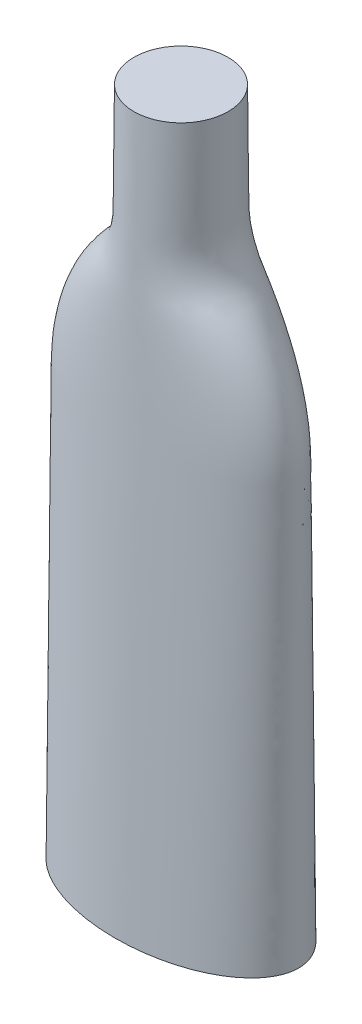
SolidWorks part; units mm, degrees
ref_plane "Front Plane" through (0, 0, 0) normal (0, 0, 1) x (1, 0, 0)
ref_plane "Top Plane" through (0, 0, 0) normal (0, 1, 0) x (1, 0, 0)
ref_plane "Right Plane" through (0, 0, 0) normal (1, 0, 0) x (0, 0, -1)
ref_plane "Plane1" through (0, 150, 0) normal (0, 1, 0) x (-1, 0, 0)
sketch "Sketch1" plane through (0, 0, 0) normal (0, 1, 0) x (1, 0, 0)
  ellipse E0 centre (0, 0) end of major axis (25, 0) minor radius 14
  dimension "D1" = 28
  dimension "D2" = 50
sketch "Sketch2" plane through (0, 150, 0) normal (0, 1, 0) x (-1, 0, 0)
  circle A0 centre (0, 0) radius 10
  dimension "D1" = 20
sketch "Sketch3" plane through (-0.4042, 0, 0) normal (0, 0, -1) x (-1, 0, 0)
  line L2 (9.5958, 150) -> (9.5958, 127.7492)
  line L3 (9.5958, 150) -> (-10.4042, 150) construction
  line L4 (24.5958, 90) -> (24.5958, 0)
  arc A2 (9.5958, 127.7492) -> (13.6867, 117.4539) centre (24.5958, 127.7492) ccw
  arc A3 (13.6867, 117.4539) -> (24.5958, 90) centre (-15.4042, 90) cw
  dimension "D3" = 15
  dimension "D2" = 40
  dimension "D1" = 90
sketch "Sketch4" plane through (0, 0, 0) normal (0, 0, 1) x (1, 0, 0)
  line L0 (10, 150) -> (10, 127.7492)
  line L1 (10, 150) -> (-10, 150) construction
  line L2 (25, 90) -> (25, 0)
  arc A0 (10, 127.7492) -> (14.0909, 117.4539) centre (25, 127.7492) ccw
  arc A1 (14.0909, 117.4539) -> (25, 90) centre (-15, 90) cw
loft "Loft1" add profiles "Sketch1", "Sketch2"
